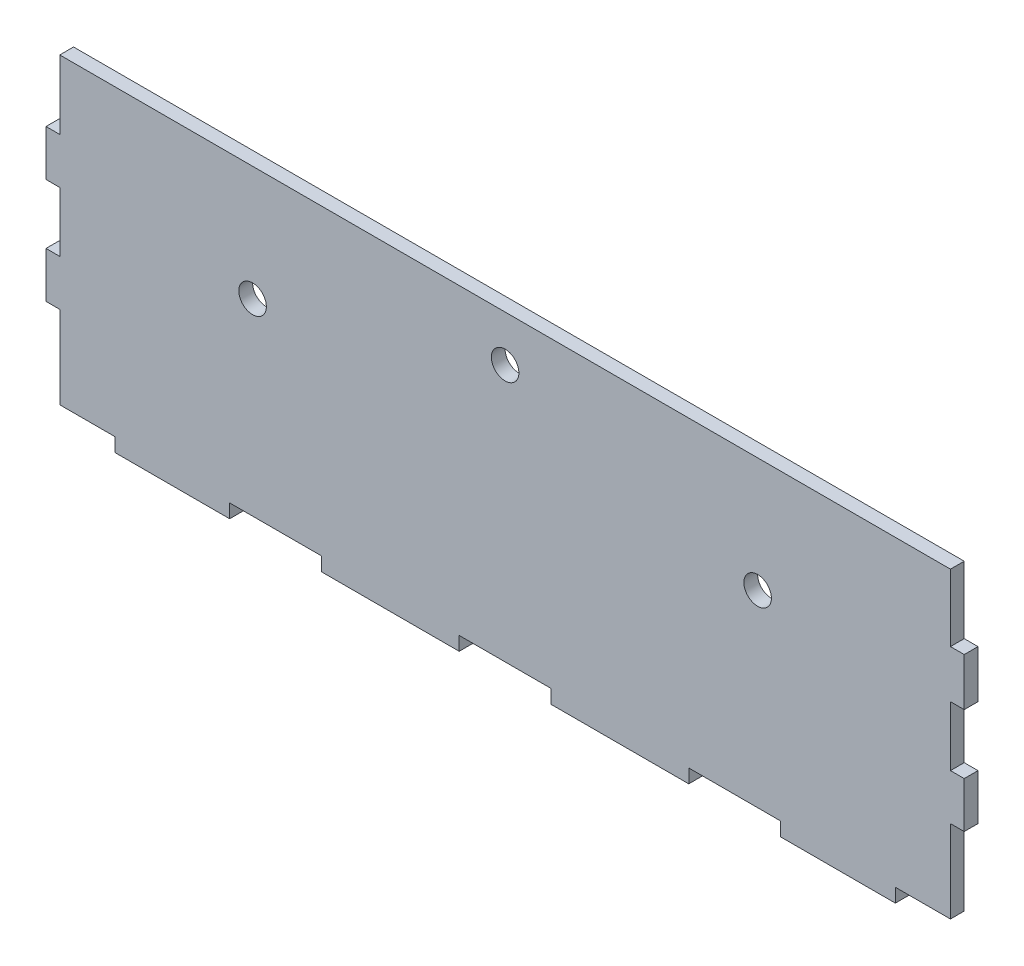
SolidWorks part; units mm, degrees
ref_plane "Alzado" through (0, 0, 0) normal (0, 0, 1) x (1, 0, 0)
ref_plane "Planta" through (0, 0, 0) normal (0, 1, 0) x (1, 0, 0)
ref_plane "Vista lateral" through (0, 0, 0) normal (1, 0, 0) x (0, 0, -1)
sketch "Croquis1" plane through (0, 0, 0) normal (0, 0, 1) x (1, 0, 0)
  line L1 (0, 0) -> (200, 0)
  line L2 (0, 0) -> (0, 75)
  line L3 (0, 75) -> (200, 75)
  line L4 (200, 0) -> (200, 75)
extrude "Saliente-Extruir1" add sketch "Croquis1" along normal blind 3
sketch "Croquis2" plane through (0, 0, 3) normal (0, 0, 1) x (1, 0, 0)
  line L0 (0, 75) -> (15, 75)
  line L1 (200, 75) -> (0, 75) construction
  line L4 (3, 66) -> (3, 54)
  line L5 (3, 3) -> (3, 21)
  line L8 (40, 75) -> (60, 75)
  line L10 (3, 21) -> (0, 21)
  line L13 (90, 75) -> (110, 75)
  line L15 (0, 75) -> (0, 0) construction
  line L18 (140, 75) -> (160, 75)
  line L22 (0, 21) -> (0, 0)
  line L23 (185, 75) -> (160, 75)
  line L24 (140, 75) -> (110, 75)
  line L25 (185, 3) -> (197, 3)
  line L26 (185, 0) -> (185, 3)
  line L27 (160, 3) -> (160, 0)
  line L28 (140, 0) -> (160, 0)
  line L29 (140, 3) -> (140, 0)
  line L30 (140, 3) -> (160, 3)
  line L31 (3, 54) -> (0, 54)
  line L32 (110, 3) -> (110, 0)
  line L33 (90, 0) -> (110, 0)
  line L34 (90, 3) -> (90, 0)
  line L35 (90, 3) -> (110, 3)
  line L36 (0, 54) -> (0, 75)
  line L37 (60, 3) -> (60, 0)
  line L38 (40, 0) -> (60, 0)
  line L39 (40, 3) -> (40, 0)
  line L40 (40, 3) -> (60, 3)
  line L41 (185, 75) -> (200, 75)
  line L42 (200, 75) -> (200, 54.393)
  line L43 (15, 3) -> (3, 3)
  line L44 (15, 0) -> (15, 3)
  line L45 (0, 0) -> (15, 0)
  line L46 (200, 0) -> (200, 75) construction
  line L47 (200, 54.393) -> (197, 54.393)
  line L48 (197, 54.393) -> (197, 66)
  line L49 (197, 21) -> (200, 21)
  line L50 (200, 21) -> (200, 0)
  line L51 (200, 0) -> (185, 0)
  line L52 (197, 21) -> (197, 3)
  line L53 (90, 75) -> (60, 75)
  line L54 (40, 75) -> (15, 75)
  line L56 (3, 44) -> (0, 44)
  line L57 (3, 44) -> (3, 31)
  line L58 (3, 31) -> (0, 31)
  line L59 (0, 44) -> (0, 31)
  line L60 (197, 31) -> (200, 31)
  line L61 (197, 31) -> (197, 44)
  line L62 (197, 44) -> (200, 44)
  line L63 (200, 31) -> (200, 44)
  line L80 (197, 66) -> (197, 69)
  line L98 (3, 69) -> (3, 66)
  line L100 (3, 69) -> (197, 69)
  circle A0 centre (100, 59) radius 3
  circle A1 centre (155, 44) radius 3
  circle A2 centre (45, 44) radius 3
extrude "Cortar-Extruir1" cut sketch "Croquis2" against normal blind 6
